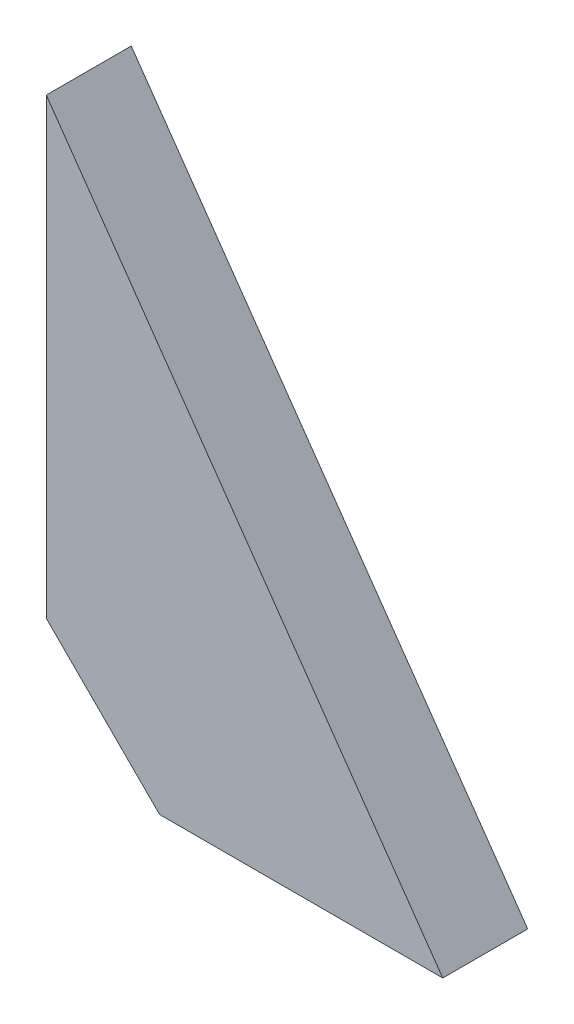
SolidWorks part; units mm, degrees
ref_plane "Alzado" through (0, 0, 0) normal (0, 0, 1) x (1, 0, 0)
ref_plane "Planta" through (0, 0, 0) normal (0, 1, 0) x (1, 0, 0)
ref_plane "Vista lateral" through (0, 0, 0) normal (1, 0, 0) x (0, 0, -1)
sketch "Sketch1" plane through (0, 0, 0) normal (0, 0, 1) x (1, 0, 0)
  line L0 (0, 20) -> (0, 4)
  line L1 (0, 4) -> (4, 0)
  line L2 (4, 0) -> (14, 0)
  line L3 (14, 0) -> (0, 20)
  dimension "D1" = 45
  dimension "D2" = 4
  dimension "D3" = 20
  dimension "D4" = 14
extrude "Boss-Extrude1" add sketch "Sketch1" along normal blind 3
